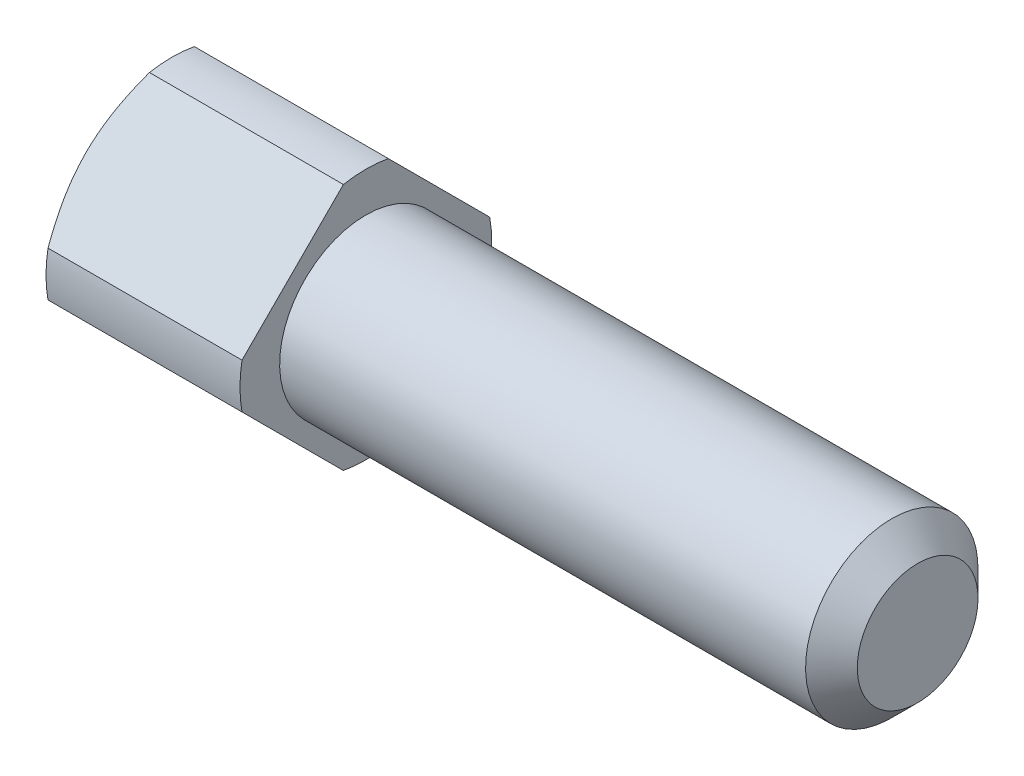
SolidWorks part; units mm, degrees
ref_plane "Front" through (0, 0, 0) normal (0, 0, 1) x (1, 0, 0)
ref_plane "Top" through (0, 0, 0) normal (0, 1, 0) x (1, 0, 0)
ref_plane "Right" through (0, 0, 0) normal (1, 0, 0) x (0, 0, -1)
sketch "Sketch1" plane through (0, 0, 0) normal (1, 0, 0) x (0, 0, -1)
  circle A0 centre (0, 0) radius 3.65
  dimension "e" = 7.3
extrude "BaseHead" add sketch "Sketch1" along normal blind 6
sketch "Sketch2" plane through (0, 1.6831, -0.1205) normal (-1, 0, 0) x (0, 0, 1)
  line L1 (4.3631, -1.6831) -> (0.1205, 2.5596)
  line L2 (0.1205, 2.5596) -> (-4.1221, -1.6831)
  line L3 (-4.1221, -1.6831) -> (0.1205, -5.9257)
  line L4 (0.1205, -5.9257) -> (4.3631, -1.6831)
  circle A0 centre (0.1205, -1.6831) radius 3 construction
  dimension "s" = 6
extrude "Cut-Extrude1" cut sketch "Sketch2" against normal blind 6 flip side to cut
sketch "Sketch3" plane through (1.2597, -5.2747, 0) normal (0, 0, 1) x (0, -1, 0)
  line L0 (-9.2897, -1.2597) -> (-8.2747, -1.2597)
  line L2 (-8.2747, -1.2597) -> (-9.2897, -0.6737)
  line L3 (-9.2897, -0.6737) -> (-9.2897, -1.2597)
  line L4 (-5.2747, 0.2856) -> (-5.2747, -6.82) construction
  line L7 (-5.9259, -1.2597) -> (-8.8662, -1.2597) construction
  dimension "D1" = 8.03
  dimension "d2" = 6
  dimension "D3" = 30
revolve "Cut-Revolve1" cut sketch "Sketch3" angle 360 about L4
sketch "Sketch4" plane through (-10.3472, 12.8472, 0) normal (0, 0, 1) x (0, -1, 0)
  line L0 (12.8472, 16.3472) -> (15.3472, 16.3472)
  line L1 (14.5972, 32.3472) -> (12.8472, 32.3472)
  line L2 (15.3472, 16.3472) -> (15.3472, 31.5972)
  line L3 (15.3472, 31.5972) -> (14.5972, 32.3472)
  line L4 (13.4984, 16.3472) -> (16.4387, 16.3472) construction
  line L5 (12.8472, 32.3472) -> (12.8472, 16.3472)
  line L6 (12.8472, 24.434) -> (12.8472, -1.2396) construction
  dimension "D1" = 45
  dimension "d" = 5
  dimension "l" = 16
  dimension "dp" = 3.5
revolve "BaseBody" add sketch "Sketch4" angle 360 about L6
fillet "HeadFillet" [suppressed] radius 0.2
sketch "Sketch5" plane through (0, 0, 0) normal (0, 0, 1) x (1, 0, 0)
  line L0 (9.2, 2.2835) -> (9.325, 2.5)
  line L1 (9.325, 2.5) -> (9.325, 2.75)
  line L2 (9.325, 2.75) -> (9.075, 2.75)
  line L3 (9.075, 2.75) -> (9.075, 2.5)
  line L4 (9.075, 2.5) -> (9.2, 2.2835)
  line L5 (0, 0) -> (22.608, 0) construction
  line L7 (22, -1.75) -> (22, 1.75) construction
  dimension "D1" = 5
  dimension "D2" = 0.25
  dimension "D3" = 12.8
revolve "Cut-Revolve10" [suppressed] cut sketch "Sketch5" angle 360 about L5
pattern_linear "LPattern10" [suppressed] count 43 spacing 0.3 along (1, 0, 0)
equation "\"d2@Sketch3\" = \"s@Sketch2\""
equation "\"D1@Sketch3\" = \"e@Sketch1\" * 1.1"
equation "\"k+c@BaseHead\" = \"k@Cut-Extrude1\""
equation "\"D1@Sketch5\" = \"d@Sketch4\""
equation "\"D2@Sketch5\" =  ( \"d@Sketch4\" - \"d@ThreadCosmetic1\" )  / 2"
equation "\"D3@LPattern10\" = \"D2@Sketch5\" * 1.2"
equation "\"D1@LPattern10\" = \"D1@ThreadCosmetic1\" / \"D3@LPattern10\""
equation "\"D3@Sketch5\" = \"D1@ThreadCosmetic1\""
